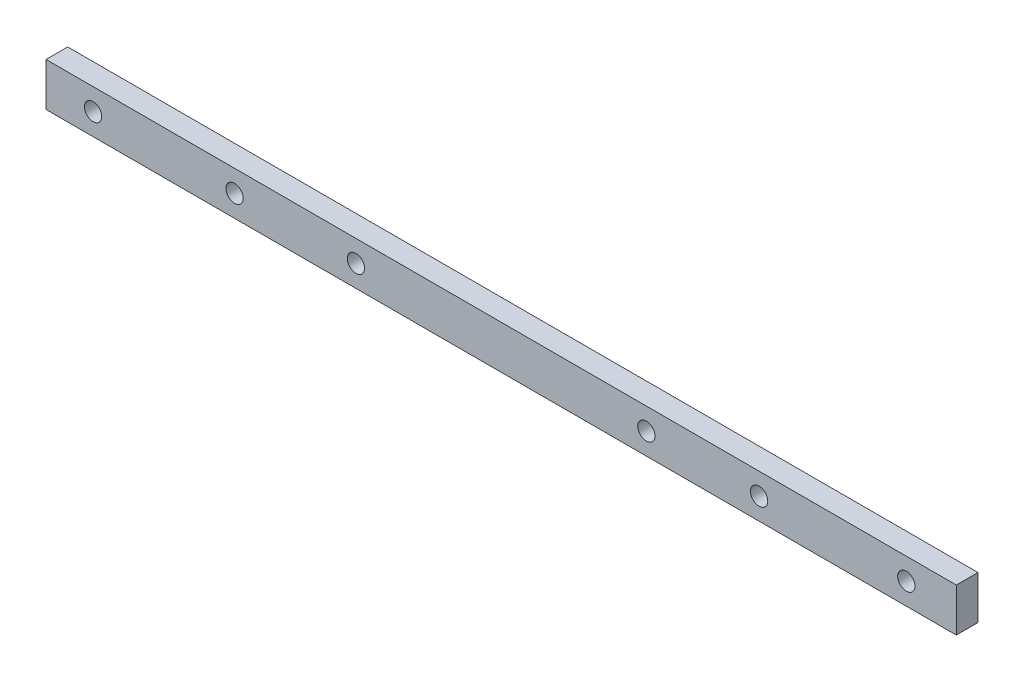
SolidWorks part; units mm, degrees
ref_plane "Front Plane" through (0, 0, 0) normal (0, 0, 1) x (1, 0, 0)
ref_plane "Top Plane" through (0, 0, 0) normal (0, 1, 0) x (1, 0, 0)
ref_plane "Right Plane" through (0, 0, 0) normal (1, 0, 0) x (0, 0, -1)
sketch "Sketch1" plane through (0, 0, 0) normal (0, 0, 1) x (1, 0, 0)
  line L1 (-105, 5) -> (105, 5)
  line L2 (-105, 5) -> (-105, -5)
  line L3 (-105, -5) -> (105, -5)
  line L4 (105, 5) -> (105, -5)
extrude "Boss-Extrude1" add sketch "Sketch1" along normal blind 5
sketch "Sketch2" plane through (0, 0, 5) normal (0, 0, 1) x (1, 0, 0)
  line L0 (0, 0) -> (0, 19.7617) construction
  line L1 (2.5, 0) -> (2.5, 19.7617) construction
  line L2 (-2.5, 19.7617) -> (-2.5, 0) construction
  circle A0 centre (59.5, 0) radius 2
  circle A1 centre (93.468, 0) radius 2
  circle A3 centre (33.5, 0) radius 2
  circle A4 centre (-33.5, 0) radius 2
  circle A5 centre (-61.5, 0) radius 2
  circle A6 centre (-94.1387, 0) radius 2
  dimension "D2" = 31
  dimension "D3" = 33.968
  dimension "D5" = 26
  dimension "D6" = 2.5
  dimension "D8" = 28
  dimension "D9" = 32.6387
  dimension "D1" = 2.5
  dimension "D7" = 31
extrude "Cut-Extrude1" cut sketch "Sketch2" against normal blind 5
sketch "Sketch3" plane through (0, 0, 5) normal (0, 0, 1) x (1, 0, 0)
  line L0 (-105, 0) -> (105, 0)
  line L1 (-105, 5) -> (-105, -5) construction
  line L2 (105, -5) -> (105, 5) construction
